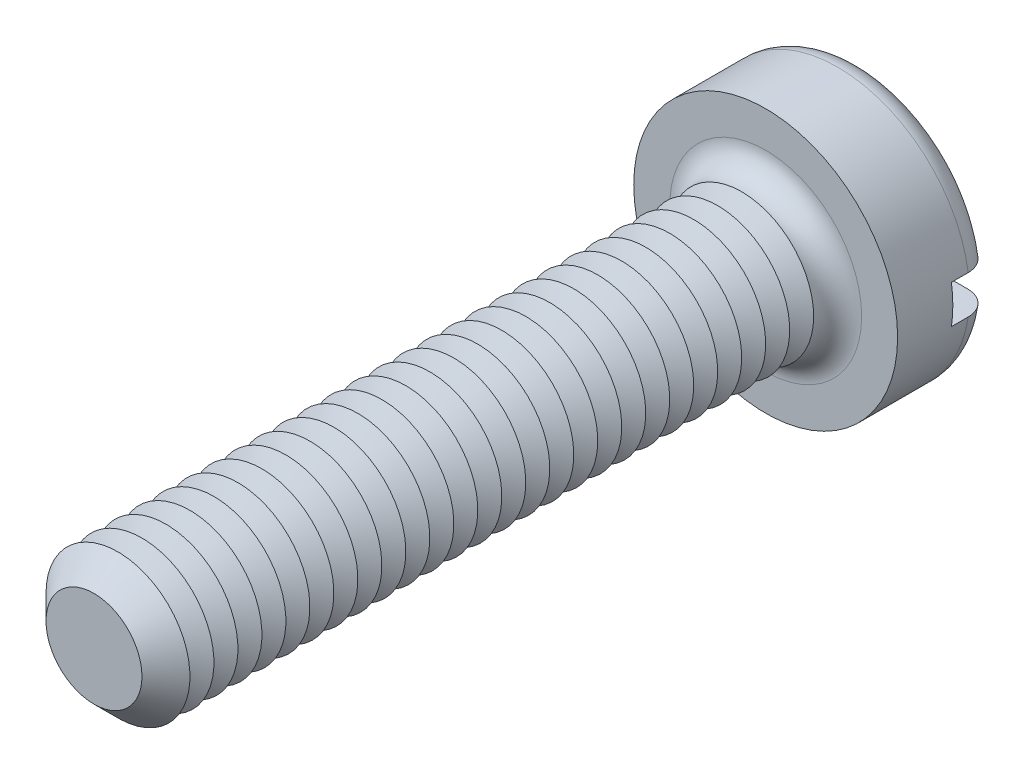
SolidWorks part; units mm, degrees
ref_plane "Front Plane" through (0, 0, 0) normal (0, 0, 1) x (1, 0, 0)
ref_plane "Top Plane" through (0, 0, 0) normal (0, 1, 0) x (1, 0, 0)
ref_plane "Right Plane" through (0, 0, 0) normal (1, 0, 0) x (0, 0, -1)
sketch "Sketch3" plane through (0, 0, 0) normal (0, 0, 1) x (1, 0, 0)
  circle A0 centre (0, 0) radius 2.75
  dimension "D1" = 5.5
extrude "Boss-Extrude2" add sketch "Sketch3" against normal blind 2
sketch "Sketch4" plane through (0, 0, 0) normal (0, 0, 1) x (1, 0, 0)
  circle A0 centre (0, 0) radius 1.5
  dimension "D1" = 3
extrude "Boss-Extrude3" add sketch "Sketch4" along normal blind 14
fillet "Fillet1" radius 0.5 2 edges at (2.75, 0, -2) (1.5, 0, 0)
chamfer "Chamfer1" distance 0.5 angle 45 1 edges at (1.5, 0, 14)
sketch "Sketch5" plane through (0, 0, 0) normal (1, 0, 0) x (0, 0, -1)
  line L0 (1.6944, 0) -> (-7.6738, 0) construction
sketch "Sketch6" plane through (0, 0, 0) normal (1, 0, 0) x (0, 0, -1)
  line L0 (-0.5, 1.5) -> (-0.75, 1.067)
  line L1 (-0.75, 1.067) -> (-1, 1.5)
  line L2 (-0.5, 1.5) -> (-13.5, 1.5) construction
  line L3 (-1, 1.5) -> (-0.5, 1.5)
  dimension "D1" = 0.5
revolve "Cut-Revolve1" cut sketch "Sketch6" angle 360 about L0
pattern_linear "LPattern1" count 26 spacing 0.5 along (0, 0, 1) of "Cut-Revolve1"
sketch "Sketch8" plane through (0, 0, -2) normal (0, 0, -1) x (-1, 0, 0)
  line L1 (2.75, -0.4) -> (-2.75, -0.4)
  line L2 (2.75, -0.4) -> (2.75, 0.4)
  line L3 (2.75, 0.4) -> (-2.75, 0.4)
  line L4 (-2.75, -0.4) -> (-2.75, 0.4)
  line L5 (2.75, -0.4) -> (-2.75, 0.4) construction
  line L6 (2.75, 0.4) -> (-2.75, -0.4) construction
  point P0 (0, 0)
  dimension "D1" = 5.5
  dimension "D2" = 0.8
extrude "Cut-Extrude1" cut sketch "Sketch8" against normal blind 0.85
